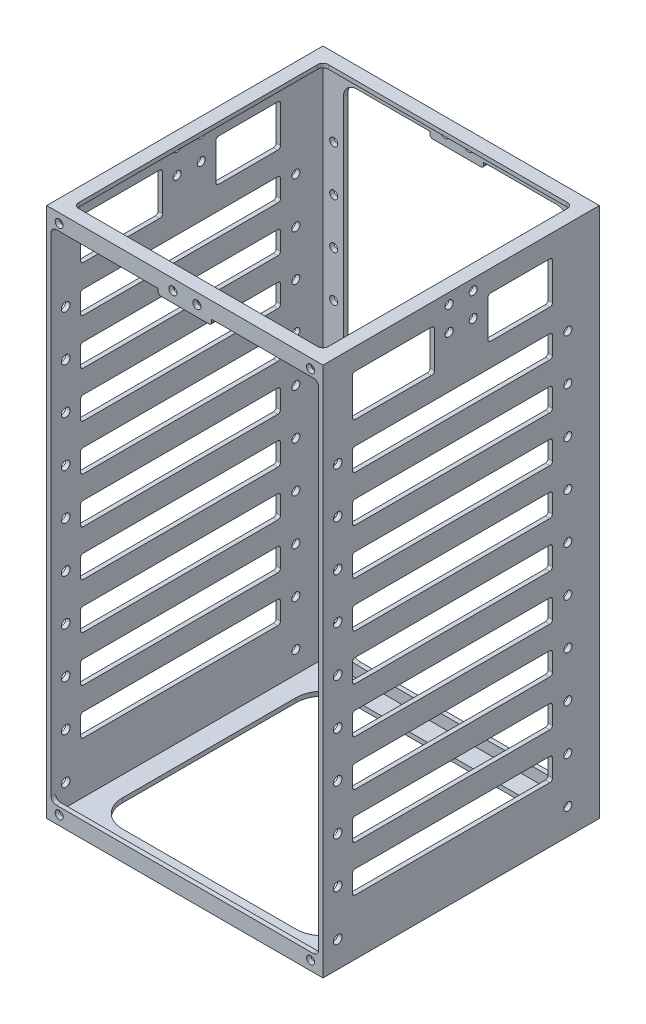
SolidWorks part; units mm, degrees
ref_plane "Front Plane" through (0, 0, 0) normal (0, 0, 1) x (1, 0, 0)
ref_plane "Top Plane" through (0, 0, 0) normal (0, 1, 0) x (1, 0, 0)
ref_plane "Right Plane" through (0, 0, 0) normal (1, 0, 0) x (0, 0, -1)
sketch "Sketch1" plane through (0, 0, 0) normal (0, 1, 0) x (1, 0, 0)
  line L1 (-51.63, -51.63) -> (51.63, -51.63)
  line L2 (-51.63, -51.63) -> (-51.63, 51.63)
  line L3 (-51.63, 51.63) -> (51.63, 51.63)
  line L4 (51.63, -51.63) -> (51.63, 51.63)
  line L5 (-51.63, -51.63) -> (51.63, 51.63) construction
  line L6 (-51.63, 51.63) -> (51.63, -51.63) construction
  line L7 (-32.5, -42.5) -> (32.5, -42.5)
  line L8 (-42.5, -32.5) -> (-42.5, 32.5)
  line L9 (-32.5, 42.5) -> (32.5, 42.5)
  line L10 (42.5, -32.5) -> (42.5, 32.5)
  line L11 (-42.5, -42.5) -> (42.5, 42.5) construction
  line L12 (-42.5, 42.5) -> (42.5, -42.5) construction
  arc A0 (32.5, -42.5) -> (42.5, -32.5) centre (32.5, -32.5) ccw
  arc A1 (32.5, 42.5) -> (42.5, 32.5) centre (32.5, 32.5) cw
  arc A2 (-42.5, 32.5) -> (-32.5, 42.5) centre (-32.5, 32.5) cw
  arc A3 (-32.5, -42.5) -> (-42.5, -32.5) centre (-32.5, -32.5) cw
  point P0 (0, 0)
  point P6 (0, 0)
  dimension "D3" = 10
  dimension "D1" = 103.26
  dimension "D2" = 42.5
extrude "Boss-Extrude2" add sketch "Sketch1" along normal blind 1.63 contours A3 L7 A0 L10 A1 L9 A2 L8 | L2 L1 L4 L3
sketch "Sketch3" plane through (0, 1.63, 0) normal (0, 1, 0) x (1, 0, 0)
  line L1 (-51.63, -51.63) -> (51.63, -51.63)
  line L2 (-51.63, -51.63) -> (-51.63, 51.63)
  line L3 (-51.63, 51.63) -> (51.63, 51.63)
  line L4 (51.63, -51.63) -> (51.63, 51.63)
  line L5 (-51.63, -51.63) -> (51.63, 51.63) construction
  line L6 (-51.63, 51.63) -> (51.63, -51.63) construction
  line L7 (-50, -50) -> (50, -50)
  line L8 (-50, -50) -> (-50, 50)
  line L9 (-50, 50) -> (50, 50)
  line L10 (50, -50) -> (50, 50)
  line L11 (-50, -50) -> (50, 50) construction
  line L12 (-50, 50) -> (50, -50) construction
  point P0 (0, 0)
  point P7 (0, 0)
  dimension "D1" = 100
extrude "Boss-Extrude3" add sketch "Sketch3" along normal blind 196.74 contours L8 L7 L10 L9 | L2 L3 L4 L1
sketch "Sketch4" plane through (0, 0, -51.63) normal (0, 0, 1) x (1, 0, 0)
  line L0 (-51.63, 0) -> (51.63, 0) construction
  line L1 (-37.38, 6) -> (37.38, 6)
  line L2 (-42.38, 11) -> (-42.38, 187.37)
  line L3 (-37.38, 192.37) -> (37.38, 192.37)
  line L4 (42.38, 11) -> (42.38, 187.37)
  line L5 (-42.38, 6) -> (42.38, 192.37) construction
  line L6 (-42.38, 192.37) -> (42.38, 6) construction
  line L7 (51.63, 198.37) -> (51.63, 0) construction
  line L8 (-50, 198.37) -> (50, 198.37) construction
  line L9 (-51.63, 198.37) -> (-51.63, 0) construction
  arc A0 (-37.38, 6) -> (-42.38, 11) centre (-37.38, 11) cw
  arc A1 (37.38, 6) -> (42.38, 11) centre (37.38, 11) ccw
  arc A2 (37.38, 192.37) -> (42.38, 187.37) centre (37.38, 187.37) cw
  arc A3 (-42.38, 187.37) -> (-37.38, 192.37) centre (-37.38, 187.37) cw
  point P0 (0, 99.185)
extrude "Cut-Extrude1" cut sketch "Sketch4" along normal up to surface (1.63 mm away)
sketch "Sketch5" plane through (0, 0, 51.63) normal (0, 0, 1) x (1, 0, 0)
  line L0 (-51.63, 198.37) -> (51.63, 198.37) construction
  line L1 (-48, 6.13) -> (48, 6.13)
  line L2 (-50, 8.13) -> (-50, 190.37)
  line L3 (-48, 192.37) -> (48, 192.37)
  line L4 (50, 8.13) -> (50, 190.37)
  line L5 (-50, 6.13) -> (50, 192.37) construction
  line L6 (-50, 192.37) -> (50, 6.13) construction
  line L7 (-51.63, 1.63) -> (51.63, 1.63) construction
  line L8 (-51.63, 198.37) -> (-51.63, 0) construction
  line L9 (51.63, 198.37) -> (51.63, 0) construction
  arc A0 (48, 6.13) -> (50, 8.13) centre (48, 8.13) ccw
  arc A1 (-48, 6.13) -> (-50, 8.13) centre (-48, 8.13) cw
  arc A2 (48, 192.37) -> (50, 190.37) centre (48, 190.37) cw
  arc A3 (-50, 190.37) -> (-48, 192.37) centre (-48, 190.37) cw
  point P0 (0, 99.25)
sketch "Sketch6" plane through (51.63, 0, 0) normal (1, 0, 0) x (0, 0, -1)
  line L0 (-51.63, 6.13) -> (-51.63, 192.37) construction
  line L2 (-51.63, 0) -> (51.63, 0) construction
  circle A0 centre (-46.13, 9.75) radius 1.6
  circle A1 centre (39.87, 9.75) radius 1.5
  circle A2 centre (-46.13, 26.85) radius 1.6
  circle A3 centre (39.87, 26.85) radius 1.5
  circle A4 centre (-46.13, 43.95) radius 1.6
  circle A5 centre (39.87, 43.95) radius 1.5
  circle A6 centre (-46.13, 61.05) radius 1.6
  circle A7 centre (39.87, 61.05) radius 1.5
  circle A8 centre (-46.13, 78.15) radius 1.6
  circle A9 centre (39.87, 78.15) radius 1.5
  circle A10 centre (-46.13, 95.25) radius 1.6
  circle A11 centre (39.87, 95.25) radius 1.5
  circle A12 centre (-46.13, 112.35) radius 1.6
  circle A13 centre (39.87, 112.35) radius 1.5
  circle A14 centre (-46.13, 129.45) radius 1.6
  circle A15 centre (39.87, 129.45) radius 1.5
  circle A16 centre (-46.13, 146.55) radius 1.6
  circle A17 centre (39.87, 146.55) radius 1.5
  circle A18 centre (-46.13, 163.65) radius 1.6
  circle A19 centre (39.87, 163.65) radius 1.5
  dimension "D4" = 3
  dimension "D5" = 3.2
  dimension "D1" = 5.5
  dimension "D2" = 86
  dimension "D3" = 9.75
  dimension "D7" = 17.1
  dimension "D9" = 17.1
  dimension "D6" = 9
  dimension "D8" = 2
extrude "Cut-Extrude2" cut sketch "Sketch6" against normal through all
extrude "Cut-Extrude3" cut sketch "Sketch5" against normal up to surface (1.63 mm away)
sketch "Sketch7" plane through (51.63, 0, 0) normal (1, 0, 0) x (0, 0, -1)
  line L0 (-40.63, 38.95) -> (-40.63, 45.45)
  line L1 (-39.63, 20.85) -> (33.12, 20.85)
  line L2 (-40.63, 21.85) -> (-40.63, 28.35)
  line L3 (-39.63, 29.35) -> (33.12, 29.35)
  line L4 (34.12, 21.85) -> (34.12, 28.35)
  line L5 (-40.63, 20.85) -> (34.12, 29.35) construction
  line L6 (-40.63, 29.35) -> (34.12, 20.85) construction
  line L7 (-40.63, 158.65) -> (-40.63, 165.15)
  line L8 (-39.63, 37.95) -> (33.12, 37.95)
  line L9 (34.12, 38.95) -> (34.12, 45.45)
  line L10 (-39.63, 46.45) -> (33.12, 46.45)
  line L11 (-40.63, 56.05) -> (-40.63, 62.55)
  line L12 (-39.63, 55.05) -> (33.12, 55.05)
  line L13 (34.12, 56.05) -> (34.12, 62.55)
  line L14 (-39.63, 63.55) -> (33.12, 63.55)
  line L15 (-40.63, 73.15) -> (-40.63, 79.65)
  line L16 (-39.63, 72.15) -> (33.12, 72.15)
  line L17 (34.12, 73.15) -> (34.12, 79.65)
  line L18 (-39.63, 80.65) -> (33.12, 80.65)
  line L19 (-40.63, 90.25) -> (-40.63, 96.75)
  line L20 (-39.63, 89.25) -> (33.12, 89.25)
  line L21 (34.12, 90.25) -> (34.12, 96.75)
  line L22 (-39.63, 97.75) -> (33.12, 97.75)
  line L23 (-40.63, 107.35) -> (-40.63, 113.85)
  line L24 (-39.63, 106.35) -> (33.12, 106.35)
  line L25 (34.12, 107.35) -> (34.12, 113.85)
  line L26 (-39.63, 114.85) -> (33.12, 114.85)
  line L27 (-40.63, 124.45) -> (-40.63, 130.95)
  line L28 (-39.63, 123.45) -> (33.12, 123.45)
  line L29 (34.12, 124.45) -> (34.12, 130.95)
  line L30 (-39.63, 131.95) -> (33.12, 131.95)
  line L31 (-40.63, 141.55) -> (-40.63, 148.05)
  line L32 (-39.63, 140.55) -> (33.12, 140.55)
  line L33 (34.12, 141.55) -> (34.12, 148.05)
  line L34 (-39.63, 149.05) -> (33.12, 149.05)
  line L35 (-39.63, 157.65) -> (33.12, 157.65)
  line L36 (34.12, 158.65) -> (34.12, 165.15)
  line L37 (-39.63, 166.15) -> (33.12, 166.15)
  line L38 (-40.63, 141.55) -> (-40.63, 158.65) construction
  circle A0 centre (-46.13, 9.75) radius 1.6 construction
  arc A1 (33.12, 29.35) -> (34.12, 28.35) centre (33.12, 28.35) cw
  arc A2 (33.12, 20.85) -> (34.12, 21.85) centre (33.12, 21.85) ccw
  arc A3 (-39.63, 20.85) -> (-40.63, 21.85) centre (-39.63, 21.85) cw
  arc A4 (-40.63, 28.35) -> (-39.63, 29.35) centre (-39.63, 28.35) cw
  arc A5 (-40.63, 45.45) -> (-39.63, 46.45) centre (-39.63, 45.45) cw
  arc A6 (-39.63, 37.95) -> (-40.63, 38.95) centre (-39.63, 38.95) cw
  arc A7 (33.12, 37.95) -> (34.12, 38.95) centre (33.12, 38.95) ccw
  arc A8 (33.12, 46.45) -> (34.12, 45.45) centre (33.12, 45.45) cw
  arc A9 (-40.63, 62.55) -> (-39.63, 63.55) centre (-39.63, 62.55) cw
  arc A10 (-39.63, 55.05) -> (-40.63, 56.05) centre (-39.63, 56.05) cw
  arc A11 (33.12, 55.05) -> (34.12, 56.05) centre (33.12, 56.05) ccw
  arc A12 (33.12, 63.55) -> (34.12, 62.55) centre (33.12, 62.55) cw
  arc A13 (-40.63, 79.65) -> (-39.63, 80.65) centre (-39.63, 79.65) cw
  arc A14 (-39.63, 72.15) -> (-40.63, 73.15) centre (-39.63, 73.15) cw
  arc A15 (33.12, 72.15) -> (34.12, 73.15) centre (33.12, 73.15) ccw
  arc A16 (33.12, 80.65) -> (34.12, 79.65) centre (33.12, 79.65) cw
  arc A17 (-40.63, 96.75) -> (-39.63, 97.75) centre (-39.63, 96.75) cw
  arc A18 (-39.63, 89.25) -> (-40.63, 90.25) centre (-39.63, 90.25) cw
  arc A19 (33.12, 89.25) -> (34.12, 90.25) centre (33.12, 90.25) ccw
  arc A20 (33.12, 97.75) -> (34.12, 96.75) centre (33.12, 96.75) cw
  arc A21 (-40.63, 113.85) -> (-39.63, 114.85) centre (-39.63, 113.85) cw
  arc A22 (-39.63, 106.35) -> (-40.63, 107.35) centre (-39.63, 107.35) cw
  arc A23 (33.12, 106.35) -> (34.12, 107.35) centre (33.12, 107.35) ccw
  arc A24 (33.12, 114.85) -> (34.12, 113.85) centre (33.12, 113.85) cw
  arc A25 (-40.63, 130.95) -> (-39.63, 131.95) centre (-39.63, 130.95) cw
  arc A26 (-39.63, 123.45) -> (-40.63, 124.45) centre (-39.63, 124.45) cw
  arc A27 (33.12, 123.45) -> (34.12, 124.45) centre (33.12, 124.45) ccw
  arc A28 (33.12, 131.95) -> (34.12, 130.95) centre (33.12, 130.95) cw
  arc A29 (-40.63, 148.05) -> (-39.63, 149.05) centre (-39.63, 148.05) cw
  arc A30 (-39.63, 140.55) -> (-40.63, 141.55) centre (-39.63, 141.55) cw
  arc A31 (33.12, 140.55) -> (34.12, 141.55) centre (33.12, 141.55) ccw
  arc A32 (33.12, 149.05) -> (34.12, 148.05) centre (33.12, 148.05) cw
  arc A33 (-40.63, 165.15) -> (-39.63, 166.15) centre (-39.63, 165.15) cw
  arc A34 (-39.63, 157.65) -> (-40.63, 158.65) centre (-39.63, 158.65) cw
  circle A35 centre (39.87, 9.75) radius 1.5 construction
  arc A36 (33.12, 157.65) -> (34.12, 158.65) centre (33.12, 158.65) ccw
  arc A37 (33.12, 166.15) -> (34.12, 165.15) centre (33.12, 165.15) cw
  point P0 (-3.255, 25.1)
  dimension "D5" = 1
  dimension "D3" = 5.75
  dimension "D1" = 8.5
  dimension "D2" = 11.1
  dimension "D4" = 5.5
  dimension "D7" = 8.6
  dimension "D9" = 8.6
  dimension "D6" = 8
  dimension "D8" = 2
extrude "Cut-Extrude4" cut sketch "Sketch7" against normal through all
sketch "Sketch8" plane through (51.63, 0, 0) normal (1, 0, 0) x (0, 0, -1)
  line L7 (-51.63, 198.37) -> (51.63, 198.37) construction
  line L15 (-39.63, 190.37) -> (33.12, 190.37)
  line L16 (-40.63, 189.37) -> (-40.63, 175.75)
  line L17 (-39.63, 174.75) -> (33.12, 174.75)
  line L18 (34.12, 189.37) -> (34.12, 175.75)
  line L19 (33.12, 166.15) -> (-39.63, 166.15) construction
  arc A15 (33.12, 190.37) -> (34.12, 189.37) centre (33.12, 189.37) cw
  arc A16 (33.12, 174.75) -> (34.12, 175.75) centre (33.12, 175.75) ccw
  arc A17 (-40.63, 175.75) -> (-39.63, 174.75) centre (-39.63, 175.75) ccw
  arc A18 (-39.63, 190.37) -> (-40.63, 189.37) centre (-39.63, 189.37) ccw
  circle A19 centre (-46.13, 163.65) radius 1.6 construction
  circle A20 centre (39.87, 163.65) radius 1.5 construction
  point P0 (-2.625, 162.85)
  dimension "D6" = 1
  dimension "D2" = 8.6
  dimension "D8" = 8
  dimension "D9" = 5.5
  dimension "D10" = 5.75
extrude "Cut-Extrude5" cut sketch "Sketch8" against normal through all
sketch "Sketch15" plane through (51.63, 0, 0) normal (1, 0, 0) x (0, 0, -1)
  line L0 (-50, 198.37) -> (-50, 190.37) construction
  line L7 (33.12, 190.37) -> (-39.63, 190.37) construction
  line L8 (-10, 190.37) -> (10, 190.37)
  line L9 (-10, 190.37) -> (-10, 174.75)
  line L10 (-10, 174.75) -> (10, 174.75)
  line L11 (10, 190.37) -> (10, 174.75)
  line L12 (-39.63, 174.75) -> (33.12, 174.75) construction
  dimension "D1" = 20
  dimension "D2" = 40
extrude "Boss-Extrude4" add sketch "Sketch15" against normal up to surface (1.63 mm away)
sketch "Sketch16" plane through (-51.63, 0, 0) normal (-1, 0, 0) x (0, 0, 1)
  line L7 (-10, 190.37) -> (10, 190.37)
  line L8 (-10, 190.37) -> (-10, 174.75)
  line L9 (-10, 174.75) -> (10, 174.75)
  line L10 (10, 190.37) -> (10, 174.75)
extrude "Boss-Extrude5" add sketch "Sketch16" against normal up to surface (1.63 mm away)
sketch "Sketch9" plane through (51.63, 0, 0) normal (1, 0, 0) x (0, 0, -1)
  line L0 (-51.63, 198.37) -> (51.63, 198.37) construction
  line L2 (-11.0428, 189.87) -> (9.2919, 189.87) construction
  line L3 (-50, 198.37) -> (-50, 190.37) construction
  circle A0 centre (-4.5, 194.37) radius 1.5
  circle A1 centre (4.5, 194.37) radius 1.5
  circle A2 centre (4.5, 185.37) radius 1.5
  circle A3 centre (-4.5, 185.37) radius 1.5
  dimension "D1" = 3
  dimension "D3" = 9
  dimension "D5" = 3
  dimension "D2" = 4
  dimension "D4" = 45.5
  dimension "D6" = 4.5
extrude "Cut-Extrude6" cut sketch "Sketch9" against normal through all
fillet "Fillet1" radius 1 8 edges at (-50.815, 174.75, 10) (-50.815, 190.37, 10) (-50.815, 190.37, -10) (-50.815, 174.75, -10) (50.815, 190.37, 10) (50.815, 174.75, 10) (50.815, 174.75, -10) (50.815, 190.37, -10)
sketch "Sketch18" plane through (0, 0, -51.63) normal (0, 0, -1) x (-1, 0, 0)
  line L0 (-37.38, 192.37) -> (37.38, 192.37) construction
  line L1 (-10, 192.37) -> (10, 192.37)
  line L2 (-10, 192.37) -> (-10, 191.37)
  line L3 (-9, 190.37) -> (9, 190.37)
  line L4 (10, 192.37) -> (10, 191.37)
  line L6 (-50, 198.37) -> (-50, 1.63) construction
  arc A0 (9, 190.37) -> (10, 191.37) centre (9, 191.37) ccw
  arc A1 (-10, 191.37) -> (-9, 190.37) centre (-9, 191.37) ccw
  point P4 (-10, 191.87)
  dimension "D3" = 1
  dimension "D1" = 2
  dimension "D2" = 20
  dimension "D4" = 40
extrude "Boss-Extrude7" add sketch "Sketch18" against normal up to surface (1.63 mm away)
sketch "Sketch17" plane through (0, 0, 51.63) normal (0, 0, 1) x (1, 0, 0)
  line L0 (48, 192.37) -> (-48, 192.37) construction
  line L1 (-10, 192.37) -> (10, 192.37)
  line L2 (-10, 192.37) -> (-10, 191.37)
  line L3 (-9, 190.37) -> (9, 190.37)
  line L4 (10, 192.37) -> (10, 191.37)
  line L5 (-50, 198.37) -> (-50, 190.37) construction
  arc A0 (9, 190.37) -> (10, 191.37) centre (9, 191.37) ccw
  arc A1 (-10, 191.37) -> (-9, 190.37) centre (-9, 191.37) ccw
  dimension "D4" = 1
  dimension "D1" = 20
  dimension "D2" = 40
  dimension "D3" = 2
extrude "Boss-Extrude6" add sketch "Sketch17" against normal up to surface (1.63 mm away)
sketch "Sketch19" plane through (0, 0, 51.63) normal (0, 0, 1) x (1, 0, 0)
  line L0 (0, 198.37) -> (0, 190.37) construction
  line L1 (-9, 190.37) -> (9, 190.37) construction
  line L3 (-51.63, 198.37) -> (51.63, 198.37) construction
  circle A0 centre (-4.5, 194.37) radius 1.5
  circle A1 centre (4.5, 194.37) radius 1.5
  dimension "D1" = 3
  dimension "D2" = 4
  dimension "D3" = 4.5
extrude "Cut-Extrude7" cut sketch "Sketch19" against normal through all
sketch "Sketch20" plane through (0, 0, 51.63) normal (0, 0, 1) x (1, 0, 0)
  line L1 (-51.63, 0) -> (51.63, 0) construction
  line L2 (0, 198.37) -> (0, 0) construction
  line L3 (-51.63, 198.37) -> (51.63, 198.37) construction
  line L4 (-50, 198.37) -> (-50, 190.37) construction
  line L5 (-50, 8.13) -> (-50, 1.63) construction
  circle A0 centre (-46.98, 3.5) radius 1.5
  circle A1 centre (-46.98, 194.87) radius 1.5
  circle A2 centre (46.98, 3.5) radius 1.5
  circle A3 centre (46.98, 194.87) radius 1.5
  dimension "D1" = 3
  dimension "D4" = 3
  dimension "D2" = 3.02
  dimension "D3" = 3.5
  dimension "D5" = 3.02
  dimension "D6" = 3.5
extrude "Cut-Extrude8" cut sketch "Sketch20" against normal up to surface (1.63 mm away)
sketch "Sketch23" plane through (0, 0, -51.63) normal (0, 0, -1) x (-1, 0, 0)
  line L0 (-51.63, 198.37) -> (-51.63, 0) construction
  line L1 (51.63, 0) -> (-51.63, 0) construction
  line L2 (0, 198.37) -> (0, 0) construction
  line L3 (51.63, 198.37) -> (-51.63, 198.37) construction
  circle A0 centre (-46, 17.05) radius 1.5
  circle A2 centre (-46, 34.15) radius 1.5
  circle A3 centre (-46, 51.25) radius 1.5
  circle A4 centre (-46, 68.35) radius 1.5
  circle A5 centre (-46, 85.45) radius 1.5
  circle A6 centre (-46, 102.55) radius 1.5
  circle A7 centre (-46, 119.65) radius 1.5
  circle A8 centre (-46, 136.75) radius 1.5
  circle A9 centre (-46, 153.85) radius 1.5
  circle A10 centre (-46, 170.95) radius 1.5
  circle A11 centre (46, 170.95) radius 1.5
  circle A12 centre (46, 153.85) radius 1.5
  circle A13 centre (46, 136.75) radius 1.5
  circle A14 centre (46, 119.65) radius 1.5
  circle A15 centre (46, 102.55) radius 1.5
  circle A16 centre (46, 85.45) radius 1.5
  circle A17 centre (46, 68.35) radius 1.5
  circle A18 centre (46, 51.25) radius 1.5
  circle A19 centre (46, 34.15) radius 1.5
  circle A20 centre (46, 17.05) radius 1.5
  dimension "D1" = 3
  dimension "D2" = 5.63
  dimension "D3" = 17.05
  dimension "D5" = 17.1
  dimension "D4" = 10
extrude "Cut-Extrude10" cut sketch "Sketch23" against normal up to surface (1.63 mm away)
sketch "Sketch25" plane through (0, 198.37, 0) normal (0, 1, 0) x (1, 0, 0)
  line L1 (-50, -50) -> (50, -50)
  line L2 (-50, -50) -> (-50, 50)
  line L3 (-50, 50) -> (50, 50)
  line L4 (50, -50) -> (50, 50)
  line L5 (-50, -50) -> (50, 50) construction
  line L6 (-50, 50) -> (50, -50) construction
  point P0 (0, 0)
extrude "Boss-Extrude8" add sketch "Sketch25" against normal blind 1.5
sketch "Sketch26" plane through (0, 198.37, 0) normal (0, 1, 0) x (1, 0, 0)
  line L0 (-51.63, -51.63) -> (-51.63, 51.63) construction
  line L1 (-44.63, -46.63) -> (44.63, -46.63)
  line L2 (-46.63, -44.63) -> (-46.63, 44.63)
  line L3 (-44.63, 46.63) -> (44.63, 46.63)
  line L4 (46.63, -44.63) -> (46.63, 44.63)
  line L5 (-46.63, -46.63) -> (46.63, 46.63) construction
  line L6 (-46.63, 46.63) -> (46.63, -46.63) construction
  arc A0 (-46.63, 44.63) -> (-44.63, 46.63) centre (-44.63, 44.63) cw
  arc A1 (44.63, 46.63) -> (46.63, 44.63) centre (44.63, 44.63) cw
  arc A2 (44.63, -46.63) -> (46.63, -44.63) centre (44.63, -44.63) ccw
  arc A3 (-44.63, -46.63) -> (-46.63, -44.63) centre (-44.63, -44.63) cw
  point P0 (0, 0)
  dimension "D2" = 2
  dimension "D1" = 5
extrude "Cut-Extrude11" cut sketch "Sketch26" against normal up to surface (1.5 mm away)
equation "\"D2@Sketch4\"=\"D4@Sketch4\""
equation "\"D4@Sketch5\"=\"D3@Sketch5\""
